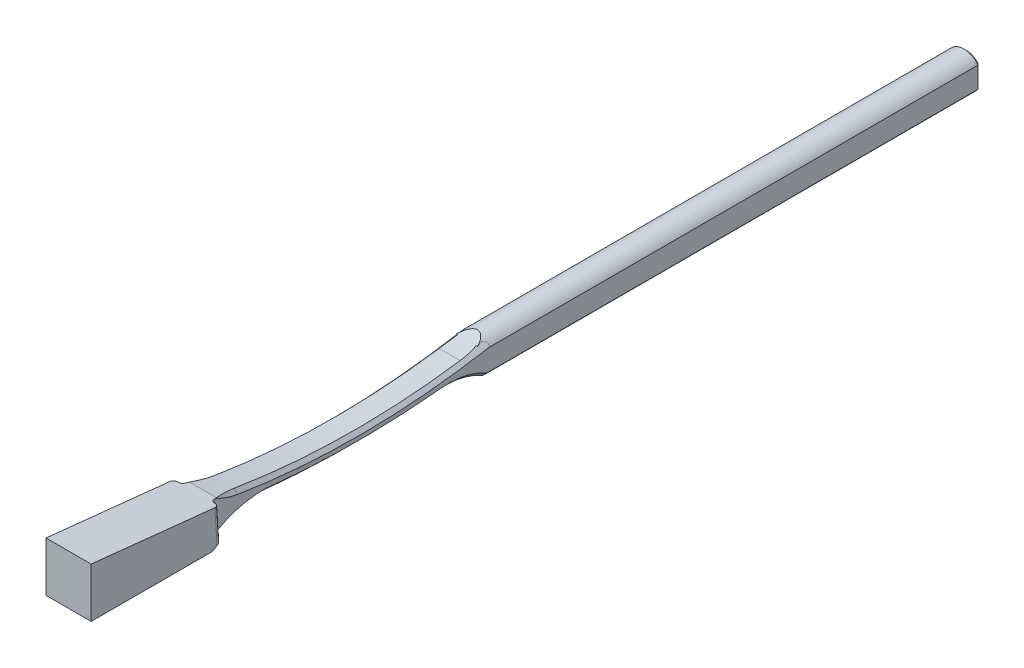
SolidWorks part; units mm, degrees
ref_plane "Front Plane" through (0, 0, 0) normal (0, 0, 1) x (1, 0, 0)
ref_plane "Top Plane" through (0, 0, 0) normal (0, 1, 0) x (1, 0, 0)
ref_plane "Right Plane" through (0, 0, 0) normal (1, 0, 0) x (0, 0, -1)
sketch "Sketch2" plane through (0, 0, 0) normal (1, 0, 0) x (0, 0, -1)
  line L0 (162.5, 0.325) -> (162.5, 6.675)
  line L1 (74.0318, 6.675) -> (162.5, 6.675)
  line L2 (74.0318, 0.325) -> (162.5, 0.325)
  line L3 (74.0318, -5.4498) -> (74.0318, 9.9567) construction
  line L4 (33.2357, 2.8589) -> (33.4983, 4.9845) construction
  line L6 (49.0614, 1.977) -> (49.0614, 3.9729) construction
  line L7 (64.8942, 2.7229) -> (64.6689, 4.7738) construction
  line L341 (0, 0) -> (0, 9)
  line L342 (22, 0) -> (0, 0)
  line L343 (0, 9) -> (24.3, 6.446)
  line L344 (169.4282, 3.5) -> (-1.2005, 3.5) construction
  arc A0 (33.2357, 2.8589) -> (64.8942, 2.7229) centre (49.7243, 156.3152) ccw
  arc A1 (24.3, 6.446) -> (68.993, 5.3199) centre (49.9861, 138.4313) ccw
  arc A2 (74.0318, 0.325) -> (64.8942, 2.7229) centre (66.2295, -10.7977) ccw
  arc A3 (68.993, 5.3199) -> (74.0318, 6.675) centre (65.9348, 26.7374) ccw
  arc A4 (33.2357, 2.8589) -> (22, 0) centre (31.6916, -14.5809) ccw
  dimension "D4" = 17.508
  dimension "D5" = 154.3397
  dimension "D6" = 134.4615
  dimension "D8" = 49.9861
  dimension "D9" = 31.6916
  dimension "D10" = 49.7243
  dimension "D11" = 138.4313
  dimension "D12" = 21.6348
  dimension "D14" = 156.3152
  dimension "D16" = 13.5863
  dimension "D1" = 3.5
  dimension "D2" = 22
  dimension "D3" = 9
  dimension "D7" = 6
  dimension "D15" = 162.5
  dimension "D20" = 3.175
  dimension "D21" = 3.175
  dimension "D22" = 6.35
  dimension "D23" = 88.4682
extrude "Main Body" add sketch "Sketch2" along normal mid plane 5.08
sketch "Sketch4" plane through (0, 0, 0) normal (1, 0, 0) x (0, 0, -1)
  line L0 (23.9276, 6.4851) -> (24.277, 1.2795)
  line L7 (74.0318, 0.325) -> (162.5, 0.325)
  line L9 (162.5, 0.325) -> (162.5, 6.675)
  line L11 (162.5, 6.675) -> (74.0318, 6.675)
  line L13 (24.3, 6.446) -> (0, 9)
  line L14 (23.9276, 6.4851) -> (0, 9)
  line L15 (0, 9) -> (0, 0)
  line L16 (0, 9) -> (0, 0)
  line L17 (0, 0) -> (22, 0)
  line L18 (0, 0) -> (22, 0)
  arc A5 (74.0318, 0.325) -> (64.8942, 2.7229) centre (66.2295, -10.7977) ccw
  arc A7 (68.993, 5.3199) -> (74.0318, 6.675) centre (65.9348, 26.7374) ccw
  arc A9 (24.3, 6.446) -> (68.993, 5.3199) centre (49.9861, 138.4313) ccw
  arc A11 (33.2357, 2.8589) -> (22, 0) centre (31.6916, -14.5809) ccw
  arc A12 (24.277, 1.2795) -> (22, 0) centre (31.6916, -14.5809) ccw
  arc A13 (33.2357, 2.8589) -> (64.8942, 2.7229) centre (49.7243, 156.3152) ccw
  dimension "D2" = 86.16
  dimension "D3" = 24.3082
  dimension "D1" = 0
extrude "Head for impression" add sketch "Sketch4" along normal mid plane 8.1788
ref_plane "Plane1" through (0, -0.3484, -0.0234) normal (0, -0.9978, -0.067) x (1, 0, 0)
sketch "Sketch7" plane through (0, -0.3505, 0.008) normal (0, 0.9978, 0.067) x (1, 0, 0)
  line L0 (-2.54, 69.2258) -> (-2.54, 24.7086) construction
  line L2 (-4.0894, 22.8086) -> (-4.0894, 20.1589)
  line L3 (-2.54, 24.3324) -> (-2.54, 26.3708)
  line L4 (4.0894, 0.6342) -> (-4.0894, 0.6342) construction
  line L5 (-4.0894, 24.3396) -> (-4.0894, 0.6342) construction
  line L6 (4.5373, 20.1589) -> (4.0894, 20.1589)
  line L7 (4.5373, 26.3708) -> (4.5373, 20.1589)
  line L8 (-2.54, 26.3708) -> (-4.5373, 26.3708)
  line L9 (-4.5373, 26.3708) -> (-4.5373, 20.1589)
  line L10 (-4.5373, 20.1589) -> (-4.0894, 20.1589)
  line L11 (0, 0.0314) -> (0, -177.0531) construction
  line L12 (2.54, 26.3708) -> (4.5373, 26.3708)
  line L13 (2.54, 24.3324) -> (2.54, 26.3708)
  line L14 (4.0894, 22.8086) -> (4.0894, 20.1589)
  arc A0 (-3.3147, 23.5705) -> (-4.0894, 22.8086) centre (-3.3274, 22.8086) ccw
  arc A1 (-2.54, 24.3324) -> (-3.3147, 23.5705) centre (-3.302, 24.3324) cw
  arc A2 (2.54, 24.3324) -> (3.3147, 23.5705) centre (3.302, 24.3324) ccw
  arc A3 (3.3147, 23.5705) -> (4.0894, 22.8086) centre (3.3274, 22.8086) cw
  dimension "D1" = 0.762
  dimension "D2" = 23.6982
extrude "BLENDED RAD CUT" cut sketch "Sketch7" against normal through all and the other way through all
sketch "Sketch3" plane through (0, 0, -162.5) normal (0, 0, -1) x (-1, 0, 0)
  line L0 (-2.54, 6.675) -> (2.54, 6.675) construction
  line L1 (-2.54, 0.325) -> (2.54, 0.325) construction
  line L2 (-2.54, 0.325) -> (-2.54, 6.675) construction
  line L3 (2.54, 0.325) -> (2.54, 6.675) construction
  line L4 (-2.54, 6.675) -> (2.54, 0.325) construction
  line L8 (2.54, 0.325) -> (2.54, 6.675)
  line L9 (2.54, 6.675) -> (-2.54, 6.675)
  line L10 (-2.54, 6.675) -> (-2.54, 0.325)
  line L11 (-2.54, 0.325) -> (2.54, 0.325)
  circle A0 centre (0, 3.5) radius 3.175
  dimension "D1" = 6.35
extrude "DIA CUT TO SHANK" cut sketch "Sketch3" against normal blind 100 contours L4 A0 M16 | L4 A0 M15 M14 | A0 L4 M14 | L4 A0 M16 M17 | A0 L9 M14 | L4 A0 L11
sketch "Sketch8" plane through (0, 0, -162.5) normal (0, 0, -1) x (-1, 0, 0)
  circle A0 centre (0, 3.5) radius 2
  arc A1 (-2.54, 1.595) -> (2.54, 1.595) centre (0, 3.5) ccw construction
  dimension "D1" = 4
extrude "THREAD M-4" cut sketch "Sketch8" against normal blind 19
sketch "Sketch11" plane through (0, 0, 0) normal (1, 0, 0) x (0, 0, -1)
  line L0 (148.1658, 3.5) -> (169.1916, 3.5) construction
  line L1 (96.9452, 3.5) -> (153.2253, 3.5) construction
  line L2 (162.5, 3.5) -> (162.5, 5.15)
  line L3 (162.5, 5.15) -> (140.5, 5.15)
  line L4 (140.5, 5.15) -> (139.5086, 3.5)
  line L5 (139.5086, 3.5) -> (162.5, 3.5)
  line L6 (162.5, 1.595) -> (162.5, 5.405) construction
  dimension "D1" = 59
  dimension "D2" = 3.3
  dimension "D3" = 22
revolve "tap drill 3.3mm" cut sketch "Sketch11" angle 360 about L0
sketch "Sketch12" plane through (2.54, 0, 0) normal (1, 0, 0) x (0, 0, -1)
  arc A0 (71.7983, 1.595) -> (64.8942, 2.7229) centre (66.2295, -10.7977) ccw construction
  arc A1 (33.2357, 2.8589) -> (64.8942, 2.7229) centre (49.7243, 156.3152) ccw construction
  arc A3 (74, 0.3472) -> (64.8942, 2.7229) centre (66.2295, -10.7977) ccw
  arc A4 (33.2357, 2.8589) -> (64.8942, 2.7229) centre (49.7243, 156.3152) ccw
  arc A5 (33.2357, 2.8589) -> (21.4732, -1.613) centre (32.6919, -13.4162) ccw
  dimension "D2" = 74
ref_plane "Plane2" through (2.54, -1.613, -21.4732) normal (0, -0.6889, 0.7248) x (1, 0, 0)
sketch "Sketch13" plane through (2.54, -1.613, -21.4732) normal (0, -0.6889, 0.7248) x (1, 0, 0)
  line L0 (0, 0) -> (0, 0.635)
  line L1 (0, 0.635) -> (-0.635, 0)
  line L2 (0, 0) -> (-0.635, 0) construction
  line L5 (-0.71, -0.075) -> (0, -0.075)
  line L6 (-0.635, 0) -> (-0.71, -0.075)
  line L7 (0, 0) -> (0, -0.075)
  line L9 (0, -4.8622) -> (0, 0) construction
  dimension "D1" = 0.635
  dimension "D2" = 0.635
  dimension "D3" = 0.075
sweep "Cut-Sweep1" cut profiles "Sketch13" path "Sketch12"
sketch "Sketch14" plane through (2.54, 0, 0) normal (1, 0, 0) x (0, 0, -1)
  arc A0 (24.3, 6.446) -> (68.993, 5.3199) centre (49.9861, 138.4313) ccw construction
  arc A1 (28.0769, 5.7667) -> (78.9189, 7.1195) centre (49.9861, 138.4313) ccw
  spline S0 degree 3 poles (28.0769, 5.7667) (26.9758, 5.9486) (24.6303, 6.7695) (22.4974, 7.9487) (21.0928, 8.9024) knots 0 0 0 0 0.412935 1 1 1 1
ref_plane "Plane3" through (2.54, 8.9024, -21.0928) normal (0, 0.5618, 0.8273) x (1, 0, 0)
sketch "Sketch15" plane through (2.54, 8.9024, -21.0928) normal (0, 0.5618, 0.8273) x (1, 0, 0)
  line L0 (0, 0) -> (0, -0.635)
  line L1 (0, -0.635) -> (-0.635, 0)
  line L2 (-0.635, 0) -> (-0.835, 0.2)
  line L3 (-0.835, 0.2) -> (0, 0.2)
  line L4 (0, 0.2) -> (0, 0)
  line L5 (0, 0) -> (-0.635, 0) construction
  dimension "D1" = 0.635
  dimension "D2" = 0.635
  dimension "D3" = 0.2
sweep "Cut-Sweep2" cut profiles "Sketch15" path "Sketch14"
mirror "Mirror1" about plane through (0, 0, 0) normal (1, 0, 0) of "Cut-Sweep1", "Cut-Sweep2"
chamfer "Chamfer1" distance 0.381 angle 45 4 edges at (-2.54, 3.5, -162.5) (2.54, 3.5, -162.5) (0, 0.325, -162.5) (0, 6.675, -162.5)
